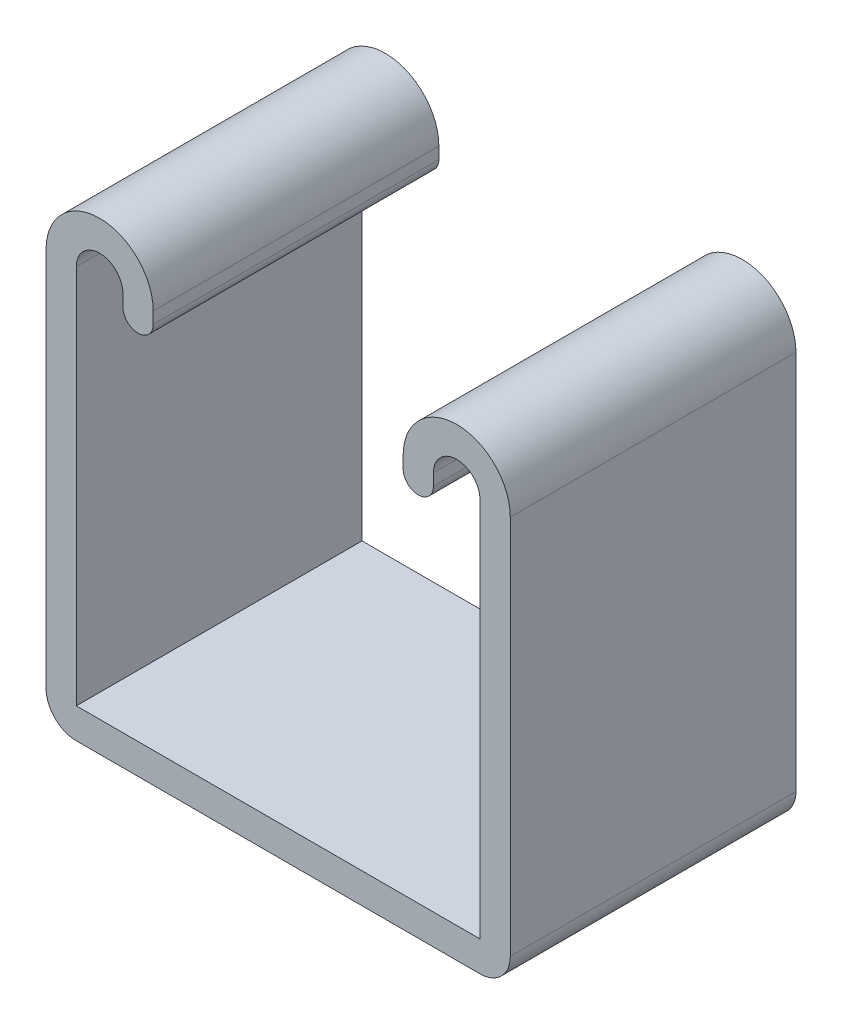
SolidWorks part; units mm, degrees
ref_plane "Plane1" through (0, 0, 0) normal (0, 0, 1) x (1, 0, 0)
ref_plane "Plane2" through (0, 0, 0) normal (0, 1, 0) x (1, 0, 0)
ref_plane "Plane3" through (0, 0, 0) normal (1, 0, 0) x (0, 0, -1)
sketch "Sketch1" plane through (0, 0, 0) normal (0, 0, 1) x (1, 0, 0)
  line L0 (-20.6375, 18.4785) -> (-20.6375, -15.3416)
  line L1 (-17.9451, -18.034) -> (17.9451, -18.034)
  line L2 (20.6375, -15.3416) -> (20.6375, 18.4785)
  line L3 (11.1125, 18.4785) -> (11.1125, 17.4434)
  line L4 (-11.1125, 18.4785) -> (-11.1125, 17.4434)
  line L5 (-13.8049, 18.4785) -> (-13.8049, 17.4434)
  line L6 (-17.9451, 18.4785) -> (-17.9451, -15.3416)
  line L7 (-17.9451, -15.3416) -> (17.9451, -15.3416)
  line L8 (17.9451, -15.3416) -> (17.9451, 18.4785)
  line L9 (13.8049, 18.4785) -> (13.8049, 17.4434)
  line L10 (-25.4, 23.241) -> (25.4, 23.241) construction
  line L11 (-12.8524, 16.0972) -> (12.8524, 16.0972) construction
  arc A0 (20.6375, 18.4785) -> (11.1125, 18.4785) centre (15.875, 18.4785) ccw
  arc A1 (-20.6375, 18.4785) -> (-11.1125, 18.4785) centre (-15.875, 18.4785) cw
  arc A2 (-17.9451, -18.034) -> (-20.6375, -15.3416) centre (-17.9451, -15.3416) cw
  arc A3 (17.9451, -18.034) -> (20.6375, -15.3416) centre (17.9451, -15.3416) ccw
  arc A4 (-17.9451, 18.4785) -> (-13.8049, 18.4785) centre (-15.875, 18.4785) cw
  arc A5 (17.9451, 18.4785) -> (13.8049, 18.4785) centre (15.875, 18.4785) ccw
  arc A6 (11.1125, 17.4434) -> (13.8049, 17.4434) centre (12.4587, 17.4434) ccw
  arc A7 (-11.1125, 17.4434) -> (-13.8049, 17.4434) centre (-12.4587, 17.4434) cw
  dimension "D1" = 2.6924
  dimension "D3" = 20.6375
  dimension "Width" = 41.275
  dimension "D5" = 18.034
  dimension "D6" = 9.525
  dimension "D7" = 22.225
  dimension "D8" = 23.241
  dimension "D9" = 7.1437
  dimension "gauge" = 2.6924
extrude "Base-Extrude" add sketch "Sketch1" along normal mid plane 25.4
equation "\"D3@Sketch1\" = \"Width@Sketch1\" / 2"
equation "\"D7@Sketch1\" = \"Width@Sketch1\" - 2 * \"D6@Sketch1\""
equation "\"D1@Sketch1\" = \"gauge@Sketch1\""
